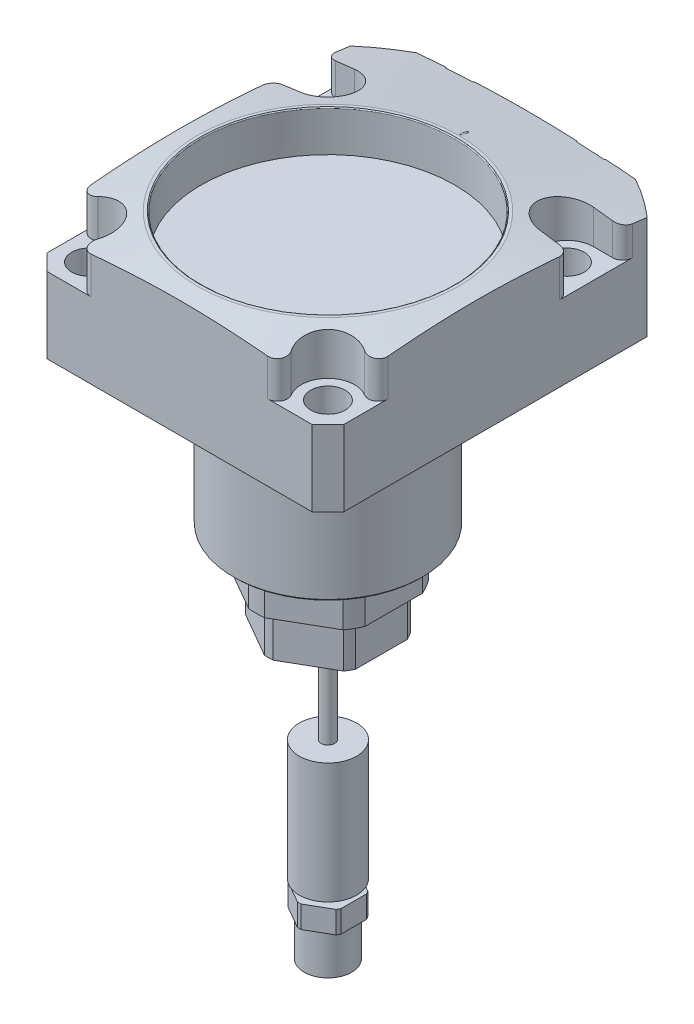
SolidWorks part; units mm, degrees
ref_plane "Front Plane" through (0, 0, 0) normal (0, 0, 1) x (1, 0, 0)
ref_plane "Top Plane" through (0, 0, 0) normal (0, 1, 0) x (1, 0, 0)
ref_plane "Right Plane" through (0, 0, 0) normal (1, 0, 0) x (0, 0, -1)
sketch "Sketch6" plane through (0, 0, 0) normal (0, 0, 1) x (1, 0, 0)
  line L0 (0, -8.9689) -> (0, 71.3762) construction
  line L1 (32.015, 30.3276) -> (33, 30.3276)
  line L2 (33, 30.3276) -> (57.15, 26.0693)
  line L3 (57.15, 26.0693) -> (57.15, 0)
  line L4 (57.15, 0) -> (23.885, 0)
  line L5 (23.885, 0) -> (23.885, -38.3032)
  line L6 (23.885, -38.3032) -> (0, -38.3032)
  line L7 (0, -38.3032) -> (0, 19.9898)
  line L8 (32.015, 30.3276) -> (32.015, 19.9898)
  line L9 (32.015, 19.9898) -> (0, 19.9898)
  dimension "D1" = 47.77
  dimension "D2" = 30.3276
  dimension "D3" = 38.3032
  dimension "D4" = 114.3
  dimension "D5" = 10
  dimension "D6" = 66
  dimension "D7" = 10.3378
  dimension "D8" = 64.03
  dimension "D9" = 68.6308
revolve "Revolve3" add sketch "Sketch6" angle 360 about L0
fillet "Fillet7" radius 0.25 1 edges at (0, 30.3276, -32.015)
sketch "Sketch7" plane through (0, 0, 0) normal (0, -1, 0) x (1, 0, 0)
  line L0 (0, 0) -> (0, -52.3237) construction
  line L1 (-37.5, 37.5) -> (37.5, 37.5)
  line L2 (-37.5, 37.5) -> (-37.5, -50)
  line L3 (-37.5, -50) -> (37.5, -50)
  line L4 (37.5, 37.5) -> (37.5, -50)
  dimension "D1" = 75
  dimension "D2" = 87.5
  dimension "D3" = 37.5
  dimension "D4" = 50
  dimension "D5" = 37.5
extrude "Cut-Extrude5" cut sketch "Sketch7" against normal through all flip side to cut
sketch "Sketch8" plane through (0, 0, 0) normal (0, -1, 0) x (1, 0, 0)
  circle A0 centre (-30.1752, 30.1752) radius 4.3688
  dimension "D1" = 8.7376
  dimension "D2" = 30.1752
  dimension "D3" = 30.1752
extrude "Cut-Extrude6" cut sketch "Sketch8" against normal through all
pattern_circular "CirPattern2" count 4 over 360 about axis through (0, 0, 0) along (0, 1, 0) of "Cut-Extrude6"
chamfer "Chamfer1" distance 4 angle 45 2 edges at (-37.5, 13.3976, 37.5) (37.5, 13.3976, 37.5)
sketch "Sketch9" plane through (0, 30.3276, 0) normal (0, 1, 0) x (1, 0, 0)
  line L0 (-37.5, -33.5) -> (-33.5, -37.5) construction
  line L1 (-33.5, -37.5) -> (33.5, -37.5) construction
  line L2 (37.5, 36.9189) -> (37.5, 23.4315)
  line L3 (-37.5, -33.5) -> (-33.5, -37.5)
  line L4 (37.5, 23.4315) -> (30.1752, 23.4315)
  line L5 (30.1752, 36.9189) -> (37.5, 36.9189)
  line L6 (-30.1752, 36.9189) -> (-37.5, 36.9189)
  line L7 (-37.5, 43.1262) -> (-37.5, -33.5) construction
  line L8 (-37.5, 23.4315) -> (-30.1752, 23.4315)
  line L9 (-37.5, 36.9189) -> (-37.5, 23.4315)
  line L10 (-33.5, -37.5) -> (-27.963, -37.5)
  line L11 (0, 0) -> (0, 26.6366) construction
  line L13 (-37.5, -27.963) -> (-34.9437, -25.4067)
  line L14 (-25.4067, -34.9437) -> (-27.963, -37.5)
  line L15 (-37.5, -27.963) -> (-37.5, -33.5)
  line L16 (37.5, -27.963) -> (37.5, -33.5)
  line L17 (25.4067, -34.9437) -> (27.963, -37.5)
  line L18 (37.5, -27.963) -> (34.9437, -25.4067)
  line L19 (33.5, -37.5) -> (27.963, -37.5)
  line L20 (37.5, -33.5) -> (33.5, -37.5)
  arc A0 (-25.4067, -34.9437) -> (-34.9437, -25.4067) centre (-30.1752, -30.1752) ccw
  arc A1 (-30.1752, 23.4315) -> (-30.1752, 36.9189) centre (-30.1752, 30.1752) ccw
  arc A2 (25.4067, -34.9437) -> (34.9437, -25.4067) centre (30.1752, -30.1752) cw
  arc A3 (30.1752, 23.4315) -> (30.1752, 36.9189) centre (30.1752, 30.1752) cw
  dimension "D1" = 13.4874
extrude "Cut-Extrude7" cut sketch "Sketch9" against normal offset from surface (11.2268 mm away) 19.1008
fillet "Fillet4" radius 2.5 8 edges at (-37.5, 23.7251, -23.4315) (37.5, 22.9841, -36.9189) (37.5, 23.7251, -23.4315) (37.5, 23.4995, 27.963) (27.963, 23.4995, 37.5) (-27.963, 23.4995, 37.5) (-37.5, 23.4995, 27.963) (-37.5, 22.9841, -36.9189)
fillet "Fillet5" radius 0.4 1 edges at (0, 0, -23.885)
chamfer "Chamfer2" distance 0.5 angle 45 1 edges at (0, -38.3032, -23.885)
ref_plane "Plane1" through (0, 17.018, 0) normal (0, -1, 0) x (1, 0, 0)
sketch "Sketch11" plane through (0, 17.018, 0) normal (0, -1, 0) x (1, 0, 0)
  line L0 (-16, -4.7006) -> (-16, -58.3255) construction
  line L1 (-27.6789, -50) -> (27.6789, -50) construction
  line L2 (-22.1849, -49.75) -> (-21.6396, -47.1846)
  line L3 (-21.6396, -47.1846) -> (-20.9784, -46.5234)
  line L10 (-16, -50) -> (-26.4775, -50)
  line L11 (-16, -35.018) -> (-16, -50)
  line L12 (-20.9784, -35.018) -> (-16, -35.018)
  line L13 (-20.9784, -46.5234) -> (-20.9784, -35.018)
  line L15 (-26.4775, -49.75) -> (-22.1849, -49.75)
  line L16 (-26.4775, -50) -> (-26.4775, -49.75)
  dimension "D1" = 16
  dimension "D2" = 0.25
  dimension "D3" = 14.732
  dimension "D4" = 9.9568
  dimension "D5" = 20.955
  dimension "D6" = 12
  dimension "D7" = 12.3698
  dimension "D8" = 45
  dimension "D9" = 2.5654
revolve "Cut-Revolve5" cut sketch "Sketch11" angle 360 about L0
ref_plane "Plane2" through (0, 0, -41.7576) normal (0, 0, 1) x (1, 0, 0)
sketch "Sketch13" plane through (0, 0, -41.7576) normal (0, 0, 1) x (1, 0, 0)
  line L0 (-19.4544, 17.7546) -> (-19.4544, 5.5009)
  line L1 (-20.572, 2.7432) -> (-20.1293, 4.826)
  line L2 (-20.572, 2.7432) -> (-21.6261, 2.7432)
  line L3 (-21.6261, 2.7432) -> (-21.6261, 0)
  line L4 (-24.285, 0) -> (24.285, 0) construction
  line L5 (-21.6261, 0) -> (-16, 0)
  line L6 (-16, 0) -> (-16, 17.7546)
  line L7 (-16, 17.7546) -> (-19.4544, 17.7546)
  line L8 (-16, 13.0098) -> (-16, -4.3918) construction
  line L9 (-20.1293, 4.826) -> (-19.4544, 5.5009)
  line L10 (-20.572, 2.7432) -> (-16, 2.7432) construction
  dimension "D1" = 16
  dimension "D2" = 6.9088
  dimension "D3" = 15.0114
  dimension "D4" = 2.7432
  dimension "D5" = 11.2522
  dimension "D6" = 45
  dimension "D7" = 2.0828
  dimension "D8" = 12
  dimension "D9" = 9.144
revolve "Cut-Revolve6" cut sketch "Sketch13" angle 360 about L8
sketch "Sketch1" plane through (-3.5242, 5.6324, -41.7576) normal (0, 0, 1) x (1, 0, 0)
  line L0 (-12.4758, 0) -> (-12.4758, 50000) construction
  line L1 (-10.8883, 2.521) -> (-8.6023, 2.521)
  line L2 (-8.6023, 2.521) -> (-8.6023, -0.3754)
  line L3 (-8.5642, -2.8892) -> (50000, -2.8892) construction
  line L4 (-9.4786, -1.289) -> (-9.4786, -1.9748)
  line L5 (-8.5642, -2.8892) -> (-7.0148, -2.8892)
  line L6 (-7.0148, -2.8892) -> (-7.0148, -4.3116)
  line L7 (-7.0148, -4.3116) -> (-7.6928, -4.3116)
  line L8 (-9.8088, -4.3116) -> (-9.8088, -5.4292)
  line L9 (-9.8088, -5.4292) -> (-10.8883, -5.4292)
  line L10 (-10.8883, -5.4292) -> (-10.8883, 2.521)
  line L11 (-1000, -2.8892) -> (-10.8883, -2.8892) construction
  line L12 (-8.1147, -4.3116) -> (-9.8088, -4.3116)
  arc A0 (-8.6023, -0.3754) -> (-9.4786, -1.289) centre (-8.5642, -1.289) ccw
  arc A1 (-9.4786, -1.9748) -> (-8.5642, -2.8892) centre (-8.5642, -1.9748) ccw
  arc A2 (-8.1147, -4.3116) -> (-7.6928, -4.3116) centre (-7.9038, -5.1752) ccw
  dimension "D8" = 1.6002
  dimension "D9" = 0.9144
  dimension "D10" = 7.9502
  dimension "D11" = 1.778
  dimension "D1" = 7.747
  dimension "D2" = 5.9944
  dimension "D3" = 10.922
  dimension "D4" = 5.334
  dimension "D5" = 3.175
  dimension "D6" = 1.4224
  dimension "D7" = 2.54
  dimension "D12" = 0.8636
revolve "Revolve1" add sketch "Sketch1" angle 360 about L0
sketch "Sketch2" plane through (-16, 0.2032, -41.7576) normal (0, -1, 0) x (0, 0, 1)
  line L0 (0, 0) -> (0, 50000) construction
  line L1 (0, 1.8331) -> (1.5875, 0.9165)
  line L2 (1.5875, 0.9165) -> (1.5875, -0.9165)
  line L3 (1.5875, -0.9165) -> (0, -1.8331)
  line L4 (0, -1.8331) -> (-1.5875, -0.9165)
  line L5 (-1.5875, -0.9165) -> (-1.5875, 0.9165)
  line L6 (-1.5875, 0.9165) -> (0, 1.8331)
  circle A0 centre (0, 0) radius 1.5875 construction
  dimension "D1" = 3.175
extrude "Cut-Extrude1" cut sketch "Sketch2" against normal up to surface (7.9502 mm away)
other "PORT_ADTAPTER<1>"
mirror "Mirror4" about plane through (0, 0, 0) normal (1, 0, 0) of "Revolve1", "Cut-Extrude1", "Cut-Revolve5", "Cut-Revolve6"
sketch "Sketch17" plane through (0, 0, 0) normal (1, 0, 0) x (0, 0, -1)
  line L0 (33.1793, 31.0677) -> (36.0752, 30.5571) construction
  line L1 (33.4924, 30.2408) -> (35.462, 29.8935) construction
  line L2 (50, 27.33) -> (33, 30.3276) construction
  line L3 (33.8704, 30.9459) -> (35.348, 30.6853) construction
  line L5 (33.7315, 30.158) -> (35.2091, 29.8975)
  line L6 (33.0825, 31.0848) -> (36.1358, 30.5464)
  arc A0 (33.0825, 31.0848) -> (33.7315, 30.158) centre (33.8704, 30.9459) ccw
  arc A1 (35.2091, 29.8975) -> (36.1358, 30.5464) centre (35.348, 30.6853) ccw
  dimension "D2" = 1.6
  dimension "D1" = 0.76
  dimension "D3" = 2
  dimension "D4" = 0.5
revolve "Cut-Revolve7" cut sketch "Sketch17" angle 360 about L0
sketch "Sketch60" plane through (0, -38.3032, 0) normal (0, -1, 0) x (1, 0, 0)
  circle A0 centre (0, 0) radius 18.923
  dimension "D1" = 37.846
extrude "Boss-Extrude22" add sketch "Sketch60" along normal blind 2.7178
sketch "Sketch76" plane through (-0.8201, -41.021, 4.3861) normal (0, -1, 0) x (1, 0, 0)
  line L1 (2.8238, -22.4106) -> (15.4279, -15.1336)
  line L2 (17.4317, -11.6631) -> (17.4317, 2.8909)
  line L3 (15.4279, 6.3615) -> (2.8238, 13.6385)
  line L4 (-1.1837, 13.6385) -> (-13.7878, 6.3615)
  line L5 (-15.7915, 2.8909) -> (-15.7915, -11.6631)
  line L6 (-13.7878, -15.1336) -> (-1.1837, -22.4106)
  circle A0 centre (0.8201, -4.3861) radius 16.6116 construction
  arc A1 (2.8238, 13.6385) -> (-1.1837, 13.6385) centre (0.8201, -4.3861) ccw
  arc A2 (-13.7878, 6.3615) -> (-15.7915, 2.8909) centre (0.8201, -4.3861) ccw
  arc A3 (-15.7915, -11.6631) -> (-13.7878, -15.1336) centre (0.8201, -4.3861) ccw
  arc A4 (-1.1837, -22.4106) -> (2.8238, -22.4106) centre (0.8201, -4.3861) ccw
  arc A5 (15.4279, -15.1336) -> (17.4317, -11.6631) centre (0.8201, -4.3861) ccw
  arc A6 (17.4317, 2.8909) -> (15.4279, 6.3615) centre (0.8201, -4.3861) ccw
  dimension "D2" = 36.2712
  dimension "D1" = 33.2232
extrude "Boss-Extrude30" add sketch "Sketch76" along normal blind 7.62
sketch "Sketch78" plane through (-0.8201, -48.641, 4.3861) normal (0, -1, 0) x (1, 0, 0)
  line L1 (14.3202, -10.9212) -> (14.3202, 2.1491)
  line L2 (13.2297, 4.0378) -> (1.9105, 10.5729)
  line L3 (-0.2704, 10.5729) -> (-11.5896, 4.0378)
  line L4 (-12.68, 2.1491) -> (-12.68, -10.9212)
  line L5 (-11.5896, -12.8099) -> (-0.2704, -19.3451)
  line L6 (1.9105, -19.3451) -> (13.2297, -12.8099)
  circle A0 centre (0.8201, -4.3861) radius 13.5001 construction
  arc A1 (1.9105, 10.5729) -> (-0.2704, 10.5729) centre (0.8201, -4.3861) ccw
  arc A2 (14.3202, 2.1491) -> (13.2297, 4.0378) centre (0.8201, -4.3861) ccw
  arc A3 (13.2297, -12.8099) -> (14.3202, -10.9212) centre (0.8201, -4.3861) ccw
  arc A4 (-0.2704, -19.3451) -> (1.9105, -19.3451) centre (0.8201, -4.3861) ccw
  arc A5 (-12.68, -10.9212) -> (-11.5896, -12.8099) centre (0.8201, -4.3861) ccw
  arc A6 (-11.5896, 4.0378) -> (-12.68, 2.1491) centre (0.8201, -4.3861) ccw
  dimension "D2" = 29.9974
  dimension "D1" = 27.0002
extrude "Boss-Extrude31" add sketch "Sketch78" along normal blind 11.2776
sketch "Sketch80" plane through (-0.8201, -59.9186, 4.3861) normal (0, -1, 0) x (1, 0, 0)
  circle A0 centre (0.8201, -4.3861) radius 1.7018
  dimension "D1" = 3.4036
extrude "Boss-Extrude32" add sketch "Sketch80" along normal blind 25.4
sketch "Sketch82" plane through (-0.8201, -85.3186, 4.3861) normal (0, -1, 0) x (1, 0, 0)
  circle A0 centre (0.8201, -4.3861) radius 7.2517
  dimension "D1" = 14.5034
extrude "Boss-Extrude33" add sketch "Sketch82" along normal blind 30.4038
sketch "Sketch84" plane through (-0.8201, -115.7224, 4.3861) normal (0, -1, 0) x (1, 0, 0)
  circle A0 centre (0.8201, -4.3861) radius 4.2545
  dimension "D1" = 8.509
extrude "Boss-Extrude34" add sketch "Sketch84" along normal blind 1.7018
sketch "Sketch86" plane through (-0.8201, -117.4242, 4.3861) normal (0, -1, 0) x (1, 0, 0)
  line L1 (-5.6823, -1.1758) -> (-5.6823, -7.5964)
  line L2 (-5.2113, -8.4122) -> (0.3491, -11.6225)
  line L3 (1.2911, -11.6225) -> (6.8515, -8.4122)
  line L4 (7.3225, -7.5964) -> (7.3225, -1.1758)
  line L5 (6.8515, -0.36) -> (1.2911, 2.8503)
  line L6 (0.3491, 2.8503) -> (-5.2113, -0.36)
  circle A0 centre (0.8201, -4.3861) radius 6.5024 construction
  arc A1 (-5.6823, -7.5964) -> (-5.2113, -8.4122) centre (0.8201, -4.3861) ccw
  arc A2 (-5.2113, -0.36) -> (-5.6823, -1.1758) centre (0.8201, -4.3861) ccw
  arc A3 (1.2911, 2.8503) -> (0.3491, 2.8503) centre (0.8201, -4.3861) ccw
  arc A4 (7.3225, -1.1758) -> (6.8515, -0.36) centre (0.8201, -4.3861) ccw
  arc A5 (6.8515, -8.4122) -> (7.3225, -7.5964) centre (0.8201, -4.3861) ccw
  arc A6 (0.3491, -11.6225) -> (1.2911, -11.6225) centre (0.8201, -4.3861) ccw
  dimension "D2" = 14.5034
  dimension "D1" = 13.0048
extrude "Boss-Extrude35" add sketch "Sketch86" along normal blind 5.588
sketch "Sketch88" plane through (-0.8201, -123.0122, 4.3861) normal (0, -1, 0) x (1, 0, 0)
  circle A0 centre (0.8201, -4.3861) radius 5.9944
  dimension "D1" = 11.9888
extrude "Boss-Extrude36" add sketch "Sketch88" along normal blind 10.2108
